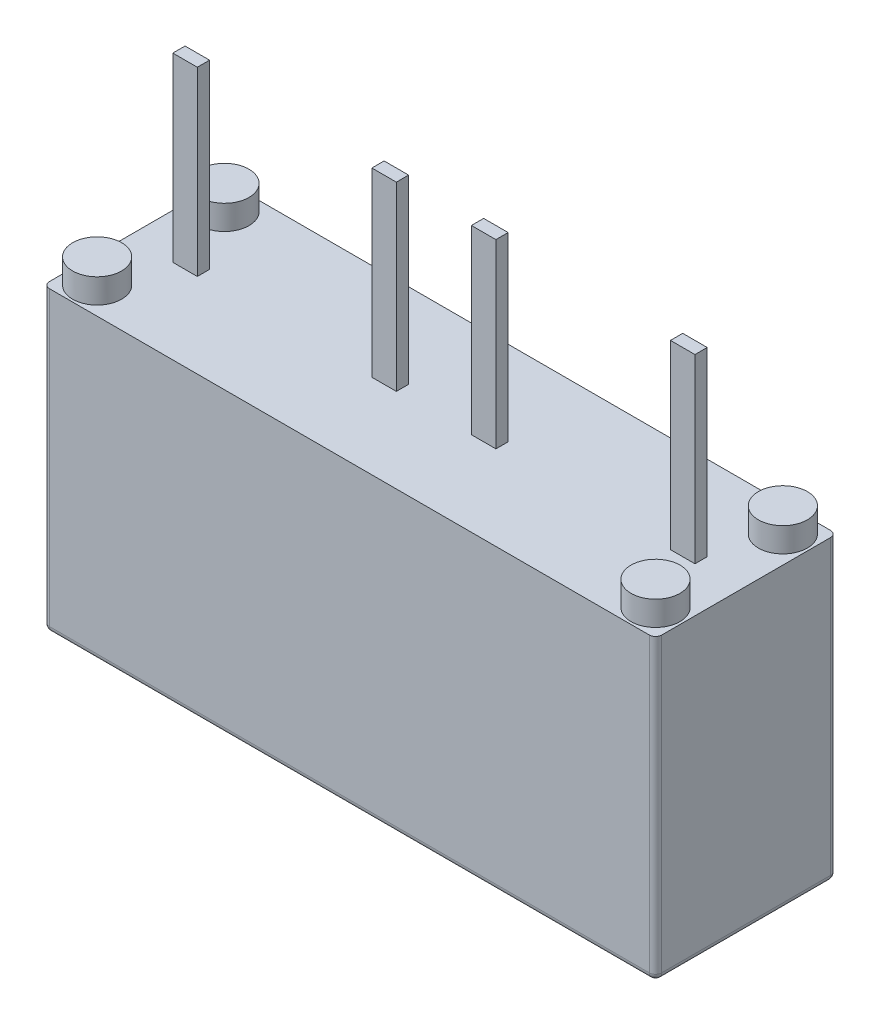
SolidWorks part; units mm, degrees
ref_plane "Front Plane" through (0, 0, 0) normal (0, 0, 1) x (1, 0, 0)
ref_plane "Top Plane" through (0, 0, 0) normal (0, 1, 0) x (1, 0, 0)
ref_plane "Right Plane" through (0, 0, 0) normal (1, 0, 0) x (0, 0, -1)
sketch "Sketch1" plane through (0, 0, 0) normal (0, 1, 0) x (1, 0, 0)
  line L1 (-6.25, 1.85) -> (6.25, 1.85)
  line L2 (-6.25, 1.85) -> (-6.25, -1.85)
  line L3 (-6.25, -1.85) -> (6.25, -1.85)
  line L4 (6.25, 1.85) -> (6.25, -1.85)
  line L5 (-6.25, 1.85) -> (6.25, -1.85) construction
  line L6 (-6.25, -1.85) -> (6.25, 1.85) construction
  point P0 (0, 0)
  dimension "D1" = 3.7
  dimension "D2" = 12.5
extrude "Boss-Extrude1" add sketch "Sketch1" along normal mid plane 6.1
sketch "Sketch2" plane through (0, 3.05, 0) normal (0, 1, 0) x (1, 0, 0)
  line L0 (6.25, 1.85) -> (-6.25, 1.85) construction
  line L1 (-6.25, 1.85) -> (-6.25, -1.85) construction
  circle A0 centre (-5.7, 1.3) radius 0.5
  dimension "D1" = 1
  dimension "D3" = 0.55
  dimension "D2" = 0.55
fillet "Fillet1" radius 0.127 8 edges at (0, -3.05, -1.85) (-6.25, -3.05, 0) (0, -3.05, 1.85) (6.25, -3.05, 0) (-6.25, 0, 1.85) (6.25, 0, -1.85) (6.25, 0, 1.85) (-6.25, 0, -1.85)
sketch "Sketch12" plane through (0, -3.05, 0) normal (0, -1, 0) x (-1, 0, 0)
  line L4 (-5.2081, -1.4807) -> (-5.5489, -1.401)
  line L5 (-5.5489, -1.401) -> (-5.2704, -0.2102)
  line L6 (-5.2704, -0.2102) -> (-5.767, -0.5599)
  line L7 (-5.767, -0.5599) -> (-5.4067, 0.9809)
  line L8 (-5.4067, 0.9809) -> (-5.6501, 1.0378)
  line L9 (-5.6501, 1.0378) -> (-5.1348, 1.2878)
  line L10 (-5.1348, 1.2878) -> (-4.8224, 0.8443)
  line L11 (-4.8224, 0.8443) -> (-5.0659, 0.9012)
  line L12 (-5.0659, 0.9012) -> (-5.2644, 0.0521)
  line L13 (-5.2644, 0.0521) -> (-4.7678, 0.4019)
  line L14 (-4.7678, 0.4019) -> (-5.2081, -1.4807)
  circle A0 centre (5.3377, 0.7253) radius 0.625
  dimension "D1" = 1.25
  dimension "D2" = 0.25
  dimension "D3" = 0.25
  dimension "D4" = 0.35
  dimension "D5" = 0.35
extrude "Boss-Extrude8" add sketch "Sketch12" along normal blind 0.001 contours A0 | L14 L13 L12 L11 L10 L9 L8 L7 L6 L5 L4
sketch "Sketch14" plane through (0, -3.05, 0) normal (0, -1, 0) x (1, 0, 0)
  line L0 (-6.0213, 0.5732) -> (-0.4367, 0.5732) construction
  line L1 (1.0984, 0.5732) -> (4.4233, 0.5732) construction
  text T0 "PICKERING" font "Arial Narrow" height 1
  text T1 "Wk/Yr" font "Arial Narrow" height 1
extrude "Boss-Extrude10" add sketch "Sketch14" along normal blind 0.001
sketch "Sketch15" plane through (0, -3.05, 0) normal (0, -1, 0) x (1, 0, 0)
  line L0 (-4.6, -1.323) -> (4.3659, -1.323) construction
  line L1 (-6.25, -1.723) -> (-6.25, 1.723) construction
  line L2 (-6.123, -1.723) -> (6.123, -1.723) construction
  text T0 "131-1-A-X/1DR" font "Arial Narrow" height 0.9
  dimension "D1" = 1.65
  dimension "D2" = 0.4
extrude "Part Number" add sketch "Sketch15" along normal blind 0.001
extrude "Boss-Extrude11" add sketch "Sketch2" along normal blind 0.5
mirror "Mirror1" about plane through (0, 0, 0) normal (1, 0, 0) of "Boss-Extrude11"
mirror "Mirror2" about plane through (0, 0, 0) normal (0, 0, 1) of "Mirror1", "Boss-Extrude11"
sketch "Sketch16" plane through (0, 3.05, 0) normal (0, 1, 0) x (1, 0, 0)
  line L0 (-6.25, 0) -> (6.25, 0) construction
  line L1 (-6.25, 1.723) -> (-6.25, -1.723) construction
  line L2 (6.25, -1.723) -> (6.25, 1.723) construction
  line L3 (0, 1.85) -> (0, -1.85) construction
  line L4 (6.123, 1.85) -> (-6.123, 1.85) construction
  line L5 (-6.123, -1.85) -> (6.123, -1.85) construction
  line L7 (0.766, 0.125) -> (1.266, 0.125)
  line L8 (0.766, 0.125) -> (0.766, -0.125)
  line L9 (0.766, -0.125) -> (1.266, -0.125)
  line L10 (1.266, 0.125) -> (1.266, -0.125)
  line L11 (0.766, 0.125) -> (1.266, -0.125) construction
  line L12 (0.766, -0.125) -> (1.266, 0.125) construction
  line L13 (4.83, 0.125) -> (5.33, 0.125)
  line L14 (4.83, 0.125) -> (4.83, -0.125)
  line L15 (4.83, -0.125) -> (5.33, -0.125)
  line L16 (5.33, 0.125) -> (5.33, -0.125)
  line L17 (4.83, 0.125) -> (5.33, -0.125) construction
  line L18 (4.83, -0.125) -> (5.33, 0.125) construction
  line L19 (-1.266, 0.125) -> (-0.766, 0.125)
  line L20 (-1.266, 0.125) -> (-1.266, -0.125)
  line L21 (-1.266, -0.125) -> (-0.766, -0.125)
  line L22 (-0.766, 0.125) -> (-0.766, -0.125)
  line L23 (-1.266, 0.125) -> (-0.766, -0.125) construction
  line L24 (-1.266, -0.125) -> (-0.766, 0.125) construction
  line L25 (-5.33, 0.125) -> (-4.83, 0.125)
  line L26 (-5.33, 0.125) -> (-5.33, -0.125)
  line L27 (-5.33, -0.125) -> (-4.83, -0.125)
  line L28 (-4.83, 0.125) -> (-4.83, -0.125)
  line L29 (-5.33, 0.125) -> (-4.83, -0.125) construction
  line L30 (-5.33, -0.125) -> (-4.83, 0.125) construction
  point P12 (1.016, 0)
  point P17 (5.08, 0)
  point P22 (-1.016, 0)
  point P27 (-5.08, 0)
  dimension "D1" = 0.5
  dimension "D2" = 0.5
  dimension "D3" = 0.5
  dimension "D4" = 0.5
  dimension "D5" = 0.25
  dimension "D6" = 0.25
  dimension "D7" = 0.25
  dimension "D8" = 0.25
  dimension "D9" = 2.032
  dimension "D10" = 1.016
  dimension "D11" = 4.064
  dimension "D12" = 4.064
extrude "Boss-Extrude12" add sketch "Sketch16" along normal blind 3.7
